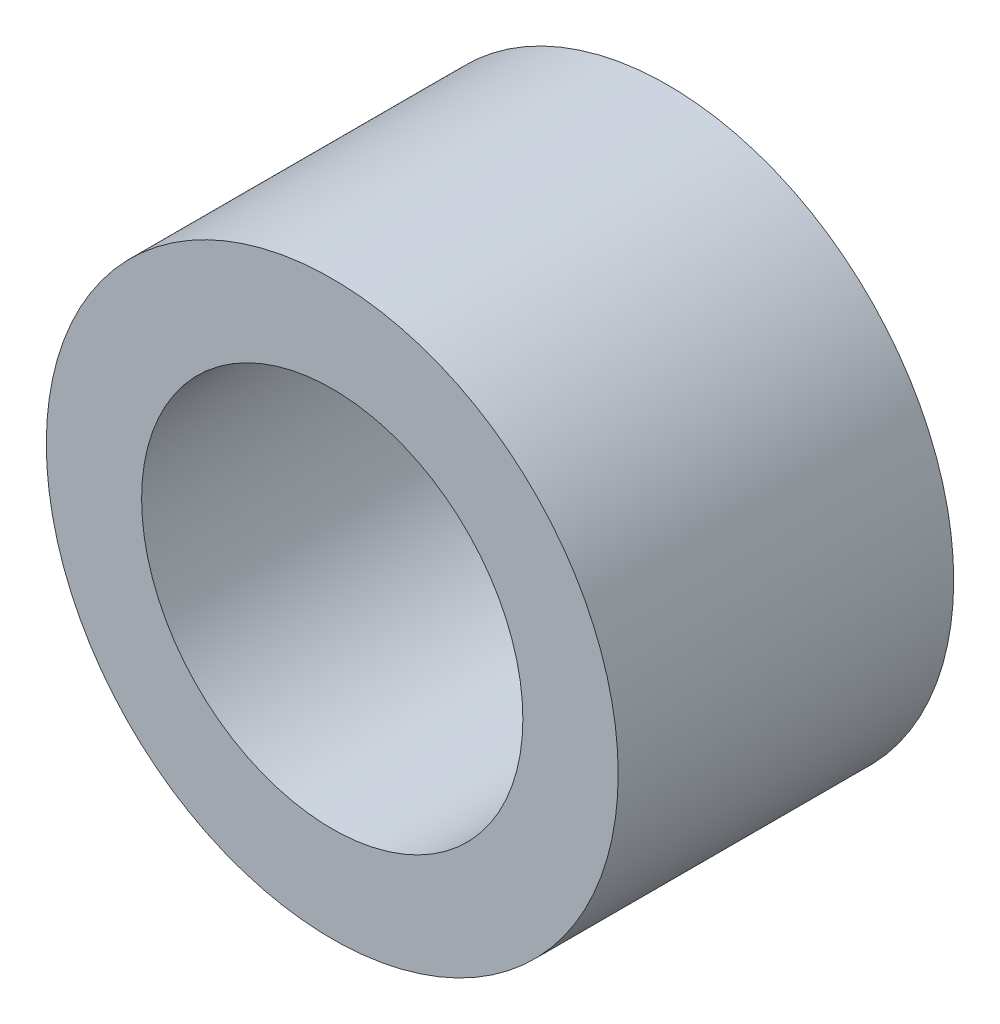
SolidWorks part; units mm, degrees
ref_plane "Plane1" through (0, 0, 0) normal (0, 0, 1) x (1, 0, 0)
ref_plane "Plane2" through (0, 0, 0) normal (0, 1, 0) x (1, 0, 0)
ref_plane "Plane3" through (0, 0, 0) normal (1, 0, 0) x (0, 0, -1)
sketch "Sketch1" plane through (0, 0, 0) normal (0, 0, 1) x (1, 0, 0)
  circle A0 centre (0, 0) radius 4.7625
  circle A1 centre (0, 0) radius 3.175
  dimension "D1" = 9.525
  dimension "D2" = 6.35
extrude "Base-Extrude" add sketch "Sketch1" along normal blind 5.588
